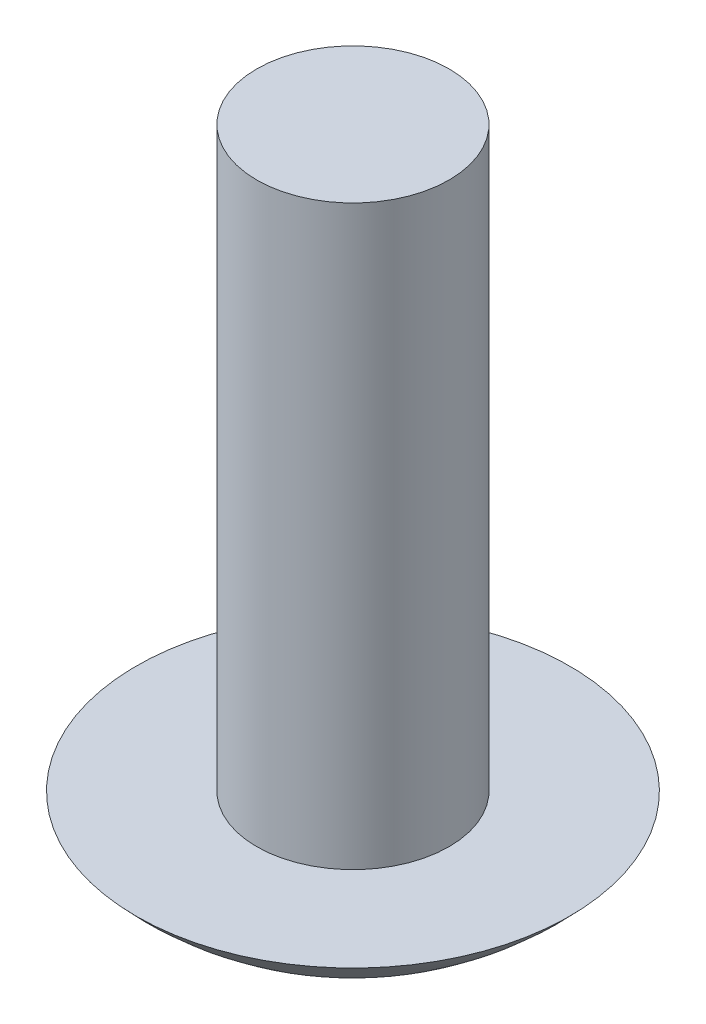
SolidWorks part; units mm, degrees
ref_plane "Front Plane" through (0, 0, 0) normal (0, 0, 1) x (1, 0, 0)
ref_plane "Top Plane" through (0, 0, 0) normal (0, 1, 0) x (1, 0, 0)
ref_plane "Right Plane" through (0, 0, 0) normal (1, 0, 0) x (0, 0, -1)
sketch "Sketch3" plane through (0, 0, 0) normal (1, 0, 0) x (0, 0, -1)
  line L0 (0, 22.225) -> (0, 0)
  line L1 (-7.1501, 3.175) -> (-3.175, 3.175)
  line L2 (-3.175, 3.175) -> (-3.175, 22.225)
  line L3 (-3.175, 22.225) -> (0, 22.225)
  arc A0 (0, 0) -> (-7.1501, 3.175) centre (0, 9.6385) cw
  dimension "D1" = 3.175
  dimension "D2" = 19.05
  dimension "D3" = 3.175
  dimension "D4" = 7.1501
revolve "Revolve1" add sketch "Sketch3" angle 360 about L0
